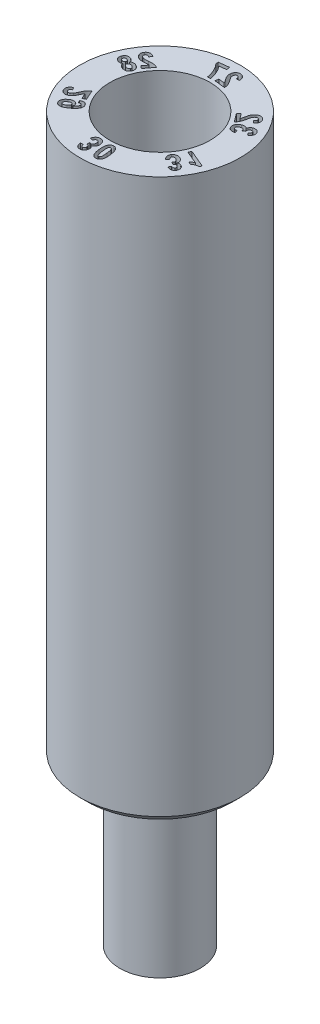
SolidWorks part; units mm, degrees
other "<M2L6-SetScrew>-<Chamfer1>" parameters "D10"=0.19
ref_plane "Front Plane" through (0, 0, 0) normal (0, 0, 1) x (1, 0, 0)
ref_plane "Top Plane" through (0, 0, 0) normal (0, 1, 0) x (1, 0, 0)
ref_plane "Right Plane" through (0, 0, 0) normal (1, 0, 0) x (0, 0, -1)
sketch "Sketch1" plane through (0, 0, 0) normal (0, 0, 1) x (1, 0, 0)
  line L0 (0, 0) -> (0, 20) construction
  line L1 (0, -2.2) -> (0, 2.2) construction
  line L2 (1, -14) -> (1.81, -14)
  line L4 (2, -13.81) -> (2, 0)
  line L5 (2, 0) -> (1.25, 0)
  line L6 (1.25, 0) -> (1.25, -2.3)
  line L7 (1.25, -2.3) -> (0.7, -2.3)
  line L8 (0.7, -2.3) -> (0.7, -10.5)
  line L9 (0.7, -10.5) -> (1, -10.5)
  line L10 (1, -10.5) -> (1, -14)
  line L11 (1.81, -14) -> (2, -13.81)
  point P6 (2, -14)
  dimension "D1" = 2.3
  dimension "D2" = 3.5
  dimension "D3" = 1.4
  dimension "D4" = 2.5
  dimension "D5" = 4
  dimension "D6" = 2
  dimension "D7" = 14
revolve "Revolve1" add sketch "Sketch1" angle 360 about L0
sketch "Sketch2" plane through (0, 0, 0) normal (0, 1, 0) x (1, 0, 0)
  line L0 (0, 0) -> (0, 2.1482) construction
  line L1 (0, 0) -> (1.8604, 1.0741) construction
  line L2 (0, 0) -> (-2.2122, -1.2772) construction
  line L3 (0, 0) -> (0, -2.1482) construction
  line L4 (0, 0) -> (2.199, -1.2696) construction
  line L5 (0, 0) -> (-1.8604, 1.0741) construction
  line L129 (0, 0) -> (1.8604, -1.0741) construction
  line L130 (0, 0) -> (-1.8604, -1.0741) construction
  arc A0 (0.302, 1.3158) -> (0.7719, 1.1076) centre (0, 0) ccw construction
  text T0 "27     28     29     30     31     32" font "Arial Narrow" height 0.48
  dimension "D1" = 2.7
  dimension "D2" = 6
extrude "Cut-Extrude1" cut sketch "Sketch2" against normal blind 0.2
inserted part "M2L6-SetScrew"
move or copy body "Body-Move/Copy2" placed by mates yes
other "Distance1" parameters "D1"=4
